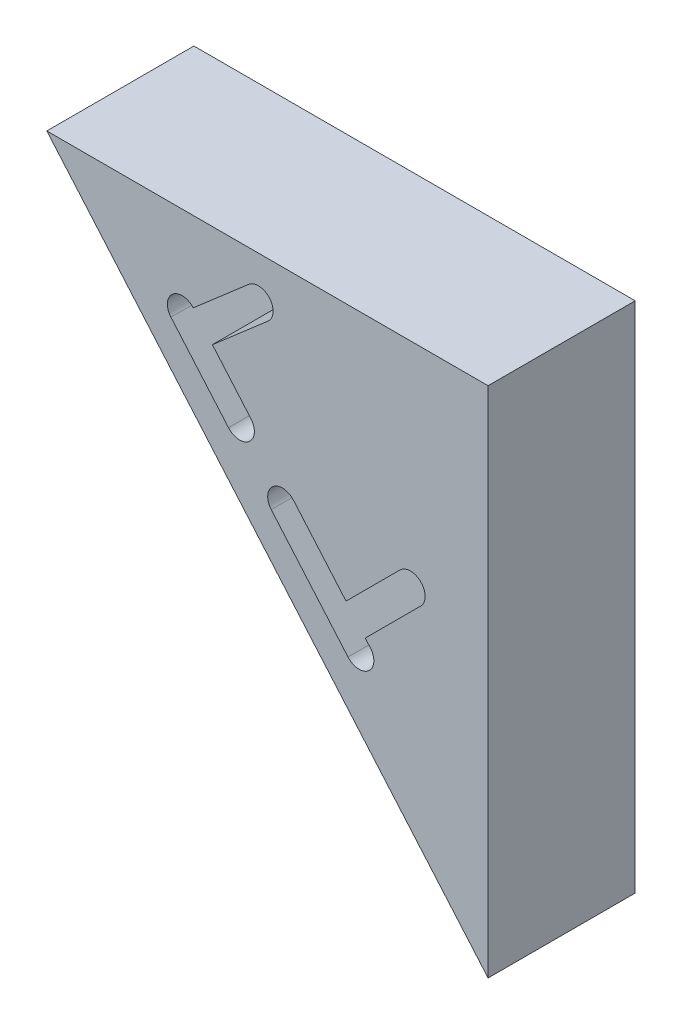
SolidWorks part; units mm, degrees
ref_plane "Plan de face" through (0, 0, 0) normal (0, 0, 1) x (1, 0, 0)
ref_plane "Plan de dessus" through (0, 0, 0) normal (0, 1, 0) x (1, 0, 0)
ref_plane "Plan de droite" through (0, 0, 0) normal (1, 0, 0) x (0, 0, -1)
sketch "Esquisse1" plane through (0, 0, 0) normal (0, 0, 1) x (1, 0, 0)
  line L0 (0, 0) -> (-15, 0)
  line L1 (-15, 0) -> (0, -17.4356)
  line L2 (0, -17.4356) -> (0, 0)
  line L3 (-10.0741, -3.4257) -> (-7.8087, -1.4614) construction
  line L4 (-10.4017, -3.048) -> (-8.1362, -1.0836)
  line L5 (-9.7465, -3.8035) -> (-7.4811, -1.8391)
  line L6 (-4.8567, -9.4903) -> (-2.6404, -7.274) construction
  line L7 (-5.2103, -9.1367) -> (-2.9939, -6.9204)
  line L8 (-4.5032, -9.8438) -> (-2.2868, -7.6275)
  line L9 (-4.3834, -10.0404) -> (-6.9921, -7.0081) construction
  line L10 (-4.7625, -10.3665) -> (-7.3712, -7.3342)
  line L11 (-4.0044, -9.7143) -> (-6.6131, -6.682)
  line L12 (-8.4451, -5.3222) -> (-10.4017, -3.048) construction
  line L15 (-8.8242, -5.6483) -> (-10.7807, -3.374)
  line L16 (-8.0661, -4.9961) -> (-10.0226, -2.7219)
  arc A2 (-10.4017, -3.048) -> (-9.7465, -3.8035) centre (-10.0741, -3.4257) ccw
  arc A3 (-7.4811, -1.8391) -> (-8.1362, -1.0836) centre (-7.8087, -1.4614) ccw
  arc A4 (-5.2103, -9.1367) -> (-4.5032, -9.8438) centre (-4.8567, -9.4903) ccw
  arc A5 (-2.2868, -7.6275) -> (-2.9939, -6.9204) centre (-2.6404, -7.274) ccw
  arc A6 (-4.7625, -10.3665) -> (-4.0044, -9.7143) centre (-4.3834, -10.0404) ccw
  arc A7 (-6.6131, -6.682) -> (-7.3712, -7.3342) centre (-6.9921, -7.0081) ccw
  arc A10 (-8.8242, -5.6483) -> (-8.0661, -4.9961) centre (-8.4451, -5.3222) ccw
  arc A11 (-10.0226, -2.7219) -> (-10.7807, -3.374) centre (-10.4017, -3.048) ccw
  point P6 (-5.6878, -8.5243)
  point P10 (-8.9414, -2.4436)
  point P17 (-3.7486, -8.3821)
  point P27 (-9.4234, -4.1851)
  point P32 (0, 0)
  point P33 (0, 0)
  point P34 (0, 0)
  point P35 (-10.0741, -3.4257)
  dimension "D5" = 0
  dimension "D6" = 1.5
  dimension "D1" = 15
  dimension "D2" = 23
  dimension "D3" = 8
  dimension "D4" = 6
  dimension "D7" = 1.5
  dimension "D8" = 1
  dimension "D9" = 1.5
  dimension "D10" = 1.5
  dimension "D11" = 4
  dimension "D12" = 4.4984
  dimension "D13" = 3
extrude "Boss.-Extru.1" add sketch "Esquisse1" along normal blind 5 contours L1 L2 L0 A11 L4 A3 L5 L16 A10 L15 A7 L11 L7 A5 L8 A6 L10
